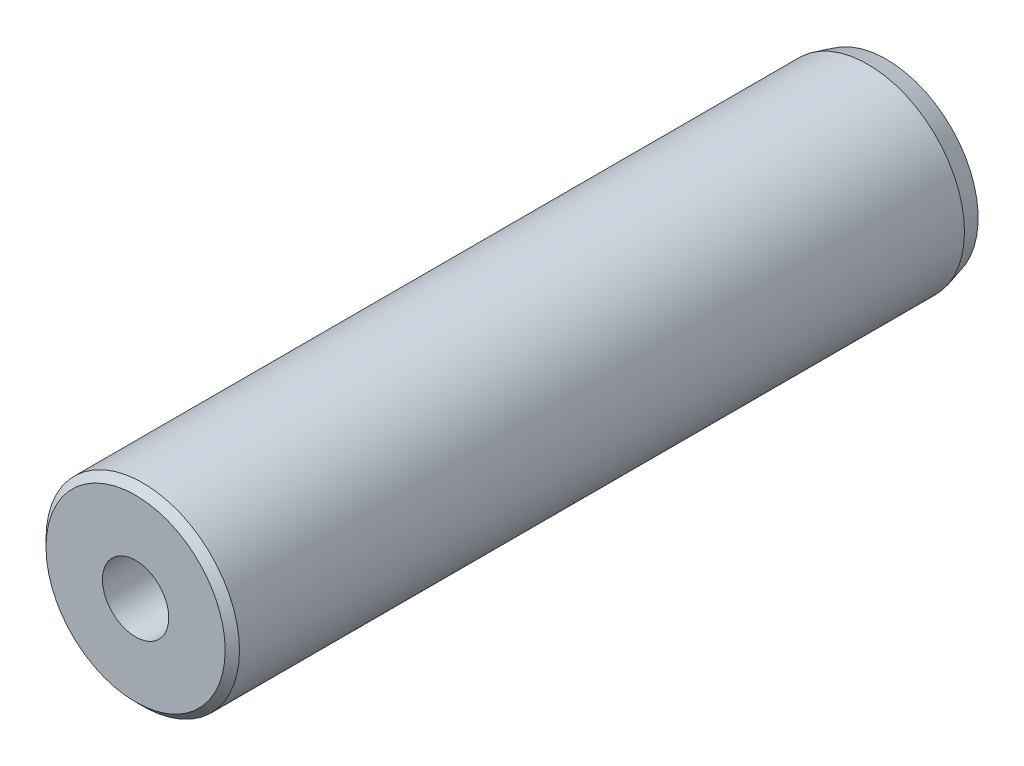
SolidWorks part; units mm, degrees
ref_plane "Front" through (0, 0, 0) normal (0, 0, 1) x (1, 0, 0)
ref_plane "Top" through (0, 0, 0) normal (0, 1, 0) x (1, 0, 0)
ref_plane "Right" through (0, 0, 0) normal (1, 0, 0) x (0, 0, -1)
sketch "Logo3_Revol_Axis" plane through (0, 0, 0) normal (0, 1, 0) x (1, 0, 0)
  line L0 (0, -30.1653) -> (0, 30.1653) construction
sketch "Logo3_bib1" plane through (0, 0, 0) normal (0, -1, 0) x (-1, 0, 0)
  line L0 (0, 38.1) -> (0, -26.2143)
  line L1 (9.525, 33.9827) -> (9.525, -37.3951)
  line L2 (3.2639, -38.1) -> (8.8202, -38.1)
  line L3 (3.2639, -38.1) -> (3.2639, -28.0987)
  line L4 (8.8202, -38.1) -> (9.525, -37.3951)
  line L5 (3.2639, -28.0987) -> (0, -26.2143)
  line L6 (9.525, 33.9827) -> (9.0319, 35.8228)
  line L10 (0, 41.5372) -> (0, -40.1764) construction
  arc A0 (9.0319, 35.8228) -> (0, 38.1) centre (0, 19.05) ccw
  point P0 (9.525, -38.1)
revolve "Revolve1" add sketch "Logo3_bib1" angle 360 about L10
equation "\"Ray1@Logo3_bib1\" = \"logo3_d1@Logo3_bib1\""
equation "\"Dia1@Logo3_bib1\" = \"logo3_d1@Logo3_bib1\""
